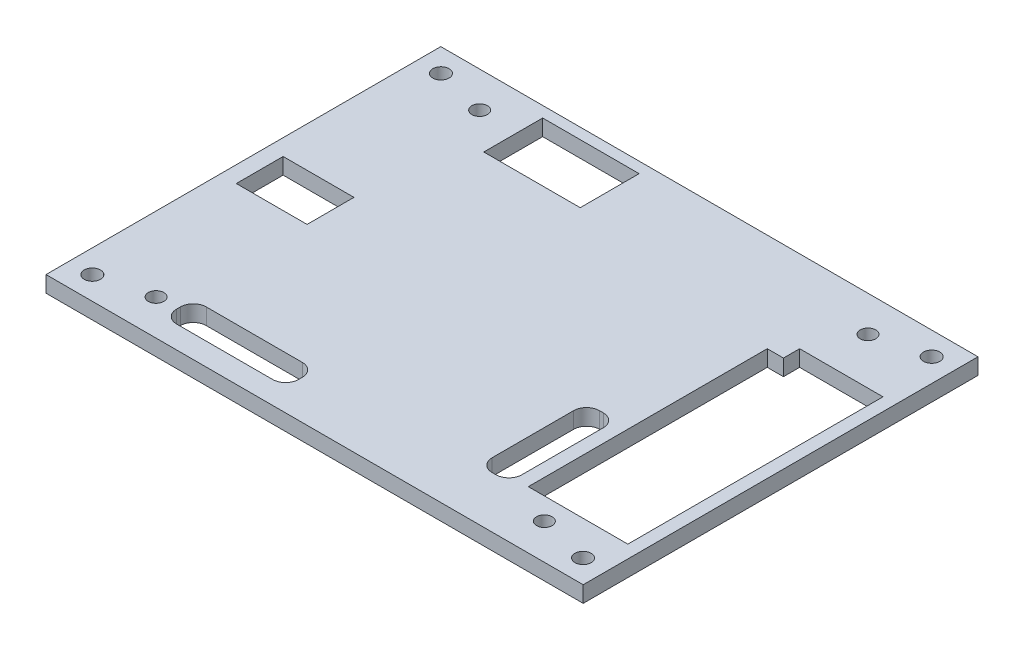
SolidWorks part; units mm, degrees
ref_plane "Front Plane" through (0, 0, 0) normal (0, 0, 1) x (1, 0, 0)
ref_plane "Top Plane" through (0, 0, 0) normal (0, 1, 0) x (1, 0, 0)
ref_plane "Right Plane" through (0, 0, 0) normal (1, 0, 0) x (0, 0, -1)
sketch "Sketch1" plane through (0, 0, 0) normal (0, 1, 0) x (1, 0, 0)
  line L1 (0, 0) -> (105.41, 0)
  line L2 (0, 0) -> (0, 77.47)
  line L3 (0, 77.47) -> (105.41, 77.47)
  line L4 (105.41, 0) -> (105.41, 77.47)
  dimension "D1" = 77.47
  dimension "D2" = 105.41
extrude "Extrude1" add sketch "Sketch1" along normal blind 3.175
sketch "Sketch2" plane through (0, 3.175, 0) normal (0, 1, 0) x (1, 0, 0)
  line L0 (0, 77.47) -> (0, 0) construction
  line L1 (105.41, 77.47) -> (0, 77.47) construction
  circle A0 centre (14.605, 70.485) radius 1.524
  circle A1 centre (90.805, 70.485) radius 1.524
  circle A2 centre (14.605, 6.985) radius 1.524
  circle A3 centre (90.805, 6.985) radius 1.524
  dimension "D1" = 3.048
  dimension "D2" = 3.048
  dimension "D3" = 3.048
  dimension "D4" = 3.048
  dimension "D5" = 76.2
  dimension "D6" = 63.5
  dimension "D7" = 14.605
  dimension "D8" = 6.985
extrude "Cut-Extrude1" cut sketch "Sketch2" against normal up to next
sketch "Sketch5" plane through (0, 3.175, 0) normal (0, 1, 0) x (1, 0, 0)
  line L0 (33.5026, 75.3364) -> (41.0464, 75.3364)
  line L1 (22.1234, 75.3364) -> (29.6672, 75.3364)
  line L2 (22.1234, 75.3364) -> (22.1234, 63.7794)
  line L3 (22.1234, 63.7794) -> (41.0464, 63.7794)
  line L4 (41.0464, 75.3364) -> (41.0464, 63.7794)
  line L5 (29.6672, 75.3364) -> (33.5026, 75.3364)
  line L6 (29.6672, 75.3364) -> (29.6672, 79.375) construction
  line L7 (29.6672, 79.375) -> (33.5026, 79.375) construction
  line L8 (33.5026, 75.3364) -> (33.5026, 79.375) construction
  line L9 (3.2004, 43.3324) -> (17.0942, 43.3324)
  line L10 (3.2004, 43.3324) -> (3.2004, 34.1376)
  line L11 (3.2004, 34.1376) -> (17.0942, 34.1376)
  line L12 (17.0942, 43.3324) -> (17.0942, 34.1376)
  line L13 (83.3628, 11.2776) -> (102.8954, 11.2776)
  line L14 (83.3628, 11.2776) -> (83.3628, 58.166)
  line L15 (86.5378, 61.341) -> (102.8954, 61.341)
  line L16 (102.8954, 11.2776) -> (102.8954, 61.341)
  line L17 (18.6817, 10.2235) -> (42.6085, 10.2235)
  line L18 (18.6817, 10.2235) -> (18.6817, 4.4069)
  line L19 (18.6817, 4.4069) -> (42.6085, 4.4069)
  line L20 (42.6085, 10.2235) -> (42.6085, 4.4069)
  line L21 (74.8919, 10.1219) -> (80.7085, 10.1219)
  line L22 (74.8919, 10.1219) -> (74.8919, 31.1785)
  line L23 (74.8919, 31.1785) -> (80.7085, 31.1785)
  line L24 (80.7085, 10.1219) -> (80.7085, 31.1785)
  line L28 (83.3628, 58.166) -> (86.5378, 58.166)
  line L29 (86.5378, 61.341) -> (86.5378, 58.166)
  circle A0 centre (14.605, 70.485) radius 1.524 construction
  circle A1 centre (90.805, 6.985) radius 1.524 construction
  circle A2 centre (14.605, 6.985) radius 1.524 construction
  dimension "D1" = 7.5184
  dimension "D2" = 26.4414
  dimension "D3" = 4.8514
  dimension "D4" = 6.7056
  dimension "D5" = 15.0622
  dimension "D6" = 18.8976
  dimension "D7" = 8.89
  dimension "D8" = 27.1526
  dimension "D12" = 4.2926
  dimension "D13" = 12.0904
  dimension "D16" = 4.0767
  dimension "D9" = 11.4046
  dimension "D10" = 13.8938
  dimension "D11" = 9.1948
  dimension "D14" = 19.5326
  dimension "D15" = 50.0634
  dimension "D17" = 23.9268
  dimension "D18" = 5.8166
  dimension "D19" = 2.5781
  dimension "D20" = 10.0965
  dimension "D21" = 5.8166
  dimension "D22" = 21.0566
  dimension "D23" = 3.1369
  dimension "D24" = 3.175
  dimension "D25" = 3.175
extrude "Cut-Extrude4" cut sketch "Sketch5" against normal up to next
sketch "Sketch6" plane through (0, 3.175, 0) normal (0, 1, 0) x (1, 0, 0)
  line L0 (52.705, 0) -> (52.705, 80.2985) construction
  line L1 (0, 0) -> (105.41, 0) construction
  line L2 (0, 38.735) -> (105.41, 38.735) construction
  line L3 (0, 77.47) -> (0, 0) construction
  line L4 (105.41, 0) -> (105.41, 77.47) construction
  circle A0 centre (4.5593, 72.9361) radius 1.6
  circle A1 centre (100.8507, 72.9361) radius 1.6
  circle A2 centre (100.8507, 4.5339) radius 1.6
  circle A3 centre (4.5593, 4.5339) radius 1.6
  dimension "D1" = 3.2
  dimension "D2" = 96.2914
  dimension "D3" = 68.4022
extrude "Cut-Extrude5" cut sketch "Sketch6" against normal up to next
fillet "Fillet1" radius 2.54 8 edges at (74.8919, 1.5875, -10.1219) (80.7085, 1.5875, -10.1219) (80.7085, 1.5875, -31.1785) (74.8919, 1.5875, -31.1785) (42.6085, 1.5875, -4.4069) (18.6817, 1.5875, -4.4069) (18.6817, 1.5875, -10.2235) (42.6085, 1.5875, -10.2235)
